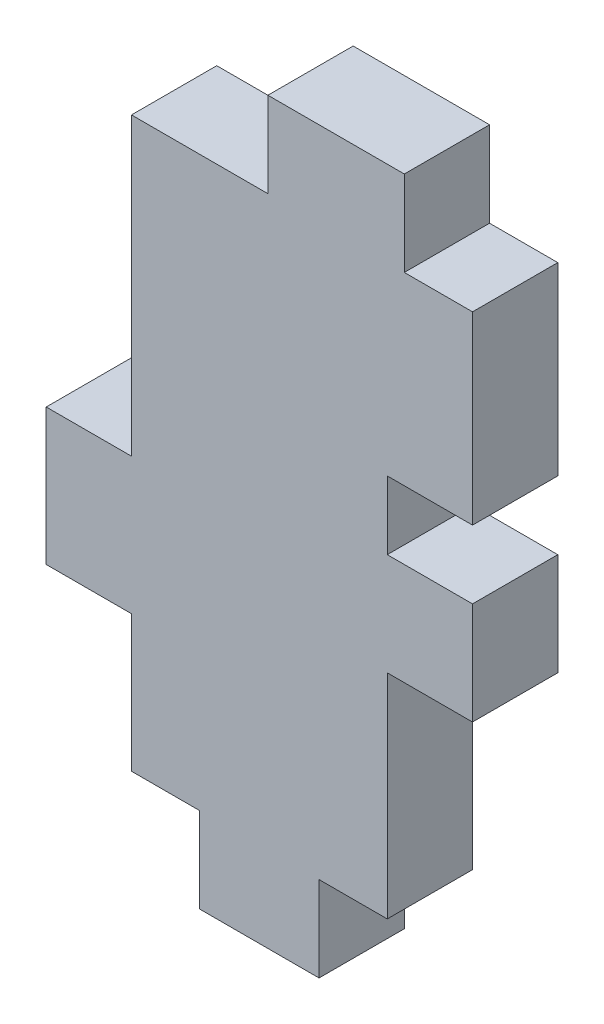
SolidWorks part; units mm, degrees
ref_plane "Front Plane" through (0, 0, 0) normal (0, 0, 1) x (1, 0, 0)
ref_plane "Top Plane" through (0, 0, 0) normal (0, 1, 0) x (1, 0, 0)
ref_plane "Right Plane" through (0, 0, 0) normal (1, 0, 0) x (0, 0, -1)
sketch "Sketch1" plane through (0, 0, 0) normal (0, 0, 1) x (1, 0, 0)
  line L1 (0, 0) -> (-19.05, 0)
  line L2 (0, 0) -> (0, 42.3333)
  line L3 (0, 42.3333) -> (-19.05, 42.3333)
  line L4 (-19.05, 0) -> (-19.05, 42.3333)
  line L9 (0, 23.495) -> (6.35, 23.495)
  line L10 (0, 23.495) -> (0, 15.875)
  line L11 (0, 15.875) -> (6.35, 15.875)
  line L12 (6.35, 23.495) -> (6.35, 15.875)
  dimension "D1" = 19.05
  dimension "D2" = 42.3333
  dimension "D3" = 7.62
  dimension "D4" = 15.875
  dimension "D5" = 6.35
extrude "Boss-Extrude2" add sketch "Sketch1" along normal blind 6.35 contours L4 L1 L2 L3 | L12 L9 L2 L11
sketch "Sketch3" plane through (0, 0, 0) normal (0, -1, 0) x (1, 0, 0)
  line L0 (0, 6.35) -> (-19.05, 6.35) construction
  line L1 (-9.525, 6.35) -> (-9.525, 0) construction
  line L2 (0, 0) -> (-19.05, 0) construction
  line L4 (-13.97, 0) -> (-5.08, 0)
  line L5 (-13.97, 0) -> (-13.97, 6.35)
  line L6 (-13.97, 6.35) -> (-5.08, 6.35)
  line L7 (-5.08, 0) -> (-5.08, 6.35)
  line L8 (-13.97, 0) -> (-5.08, 6.35) construction
  line L9 (-13.97, 6.35) -> (-5.08, 0) construction
  point P6 (-9.525, 3.175)
  dimension "D1" = 8.89
extrude "Boss-Extrude3" add sketch "Sketch3" along normal blind 6.35
sketch "Sketch4" plane through (0, 0, 0) normal (1, 0, 0) x (0, 0, -1)
  line L0 (0, 23.495) -> (0, 42.3333) construction
  line L1 (-6.35, 42.3333) -> (0, 42.3333)
  line L2 (-6.35, 42.3333) -> (-6.35, 28.575)
  line L3 (-6.35, 28.575) -> (0, 28.575)
  line L4 (0, 42.3333) -> (0, 28.575)
  line L5 (-6.35, 23.495) -> (0, 23.495) construction
  dimension "D1" = 5.08
extrude "Boss-Extrude4" add sketch "Sketch4" along normal blind 6.35
sketch "Sketch5" plane through (-19.05, 0, 0) normal (-1, 0, 0) x (0, 0, 1)
  line L0 (0, 0) -> (0, 42.3333) construction
  line L1 (0, 20.32) -> (6.35, 20.32)
  line L2 (0, 20.32) -> (0, 10.16)
  line L3 (0, 10.16) -> (6.35, 10.16)
  line L4 (6.35, 20.32) -> (6.35, 10.16)
  line L5 (6.35, 0) -> (6.35, 42.3333) construction
  line L7 (6.35, -6.35) -> (0, -6.35) construction
  dimension "D1" = 16.51
  dimension "D2" = 10.16
extrude "Boss-Extrude5" add sketch "Sketch5" along normal blind 6.35
sketch "Sketch6" plane through (0, 42.3333, 0) normal (0, 1, 0) x (1, 0, 0)
  line L0 (6.35, 0) -> (-19.05, 0) construction
  line L1 (-8.89, 0) -> (1.27, 0)
  line L2 (-8.89, 0) -> (-8.89, -6.35)
  line L3 (-8.89, -6.35) -> (1.27, -6.35)
  line L4 (1.27, 0) -> (1.27, -6.35)
  line L5 (6.35, -6.35) -> (-19.05, -6.35) construction
  line L7 (-19.05, -6.35) -> (-19.05, 0) construction
  dimension "D1" = 10.16
  dimension "D2" = 10.16
extrude "Boss-Extrude6" add sketch "Sketch6" along normal blind 6.35
sketch "Sketch7" plane through (0, 0, 6.35) normal (0, 0, 1) x (1, 0, 0)
  line L1 (6.35, 42.3333) -> (6.35, 28.575) construction
  dimension "D1" = 13.7583
